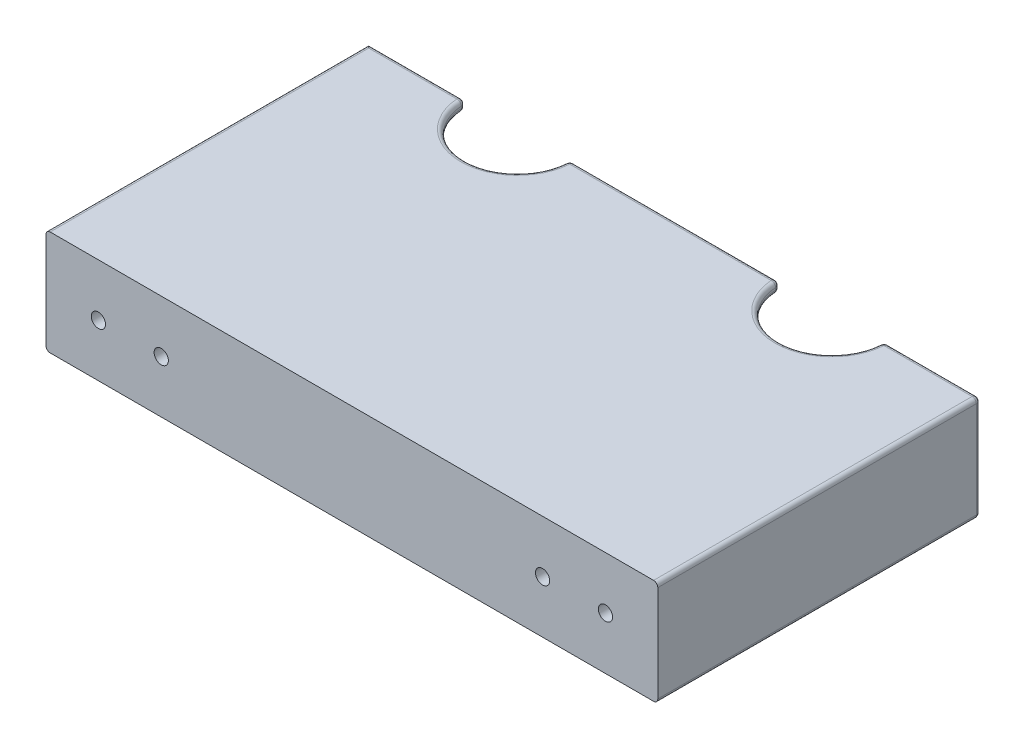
SolidWorks part; units mm, degrees
ref_plane "Front Plane" through (0, 0, 0) normal (0, 0, 1) x (1, 0, 0)
ref_plane "Top Plane" through (0, 0, 0) normal (0, 1, 0) x (1, 0, 0)
ref_plane "Right Plane" through (0, 0, 0) normal (1, 0, 0) x (0, 0, -1)
sketch "Sketch1" plane through (0, 0, 0) normal (0, 1, 0) x (1, 0, 0)
  line L1 (-73, 38.5) -> (73, 38.5)
  line L2 (-73, 38.5) -> (-73, -38.5)
  line L3 (-73, -38.5) -> (73, -38.5)
  line L4 (73, 38.5) -> (73, -38.5)
  line L5 (-73, 38.5) -> (73, -38.5) construction
  line L6 (-73, -38.5) -> (73, 38.5) construction
  point P0 (0, 0)
  dimension "D1" = 146
  dimension "D2" = 77
extrude "Boss-Extrude2" add sketch "Sketch1" along normal mid plane 25
sketch "Sketch3" plane through (0, 0, -38.5) normal (0, 0, -1) x (-1, 0, 0)
  line L1 (-70.5, -10) -> (70.5, -10)
  line L2 (-70.5, -10) -> (-70.5, 10)
  line L3 (-70.5, 10) -> (70.5, 10)
  line L4 (70.5, -10) -> (70.5, 10)
  line L5 (-70.5, -10) -> (70.5, 10) construction
  line L6 (-70.5, 10) -> (70.5, -10) construction
  point P0 (0, 0)
  dimension "D1" = 141
  dimension "D2" = 20
extrude "Cut-Extrude1" cut sketch "Sketch3" against normal blind 71
hole_wizard "CSK for M3 Countersunk Flat Head Screw1" positions "Sketch5" profile "Sketch6" countersink size "M3" standard "ISO"
sketch "Sketch5" plane through (0, 0, 32.5) normal (0, 0, -1) x (-1, 0, 0)
  line L0 (-70.5, 10) -> (-70.5, -10) construction
  line L1 (70.5, -10) -> (70.5, 10) construction
  point P0 (-60.5, 0)
  point P2 (-45.5, 0)
  point P4 (45.5, 0)
  point P6 (60.5, 0)
  point P13 (70.5, 0)
  dimension "D1" = 10
  dimension "D2" = 15
  dimension "D3" = 10
  dimension "D4" = 15
sketch "Sketch6" plane through (60.5, 0, 32.5) normal (1, 0, 0) x (0, 1, 0)
  line L0 (0, 0) -> (0, 9.0215)
  line L1 (0, 9.0215) -> (1.7, 8)
  line L2 (1.7, 8) -> (1.7, 1.45)
  line L3 (1.7, 1.45) -> (3.15, 0)
  line L5 (3.15, 0) -> (0, 0)
  line L6 (-1.7, 1.45) -> (-3.15, 0) construction
  line L10 (0, 9.0215) -> (-1.7, 8) construction
  line L11 (0, -6.35) -> (0, 107.95) construction
  dimension "Hole Dia." = 3.4
  dimension "Hole Depth" = 8
  dimension "Near C'Sink Dia." = 6.3
  dimension "Near C'Sink Angle" = 90
  dimension "Drill Angle" = 118
fillet "Fillet4" radius 1 17 edges at (0, 10, -38.5) (0, -10, -38.5) (-70.5, -10, -3) (-70.5, 0, 32.5) (-70.5, 10, -3) (-70.5, 0, -38.5) (70.5, 10, -3) (70.5, 0, 32.5) (70.5, -10, -3) (70.5, 0, -38.5) (0, -12.5, -38.5) (73, -12.5, 0) (73, 12.5, 0) (73, 0, -38.5) (0, 12.5, -38.5) (-73, -12.5, 0) (-73, 12.5, 0)
sketch "Sketch7" plane through (-73, 0, 0) normal (-1, 0, 0) x (0, 0, 1)
  line L0 (-38.5, 11.5) -> (-38.5, -11.5) construction
  line L1 (-30.5, -5) -> (30.5, -5)
  line L2 (-30.5, -5) -> (-30.5, 5)
  line L3 (-30.5, 5) -> (30.5, 5)
  line L4 (30.5, -5) -> (30.5, 5)
  line L5 (-30.5, -5) -> (30.5, 5) construction
  line L6 (-30.5, 5) -> (30.5, -5) construction
  point P0 (0, 0)
  dimension "D1" = 8
  dimension "D2" = 10
extrude "Cut-Extrude2" cut sketch "Sketch7" against normal blind 20
fillet "Fillet5" radius 1 4 edges at (-71.75, -5, 30.5) (-71.75, 5, 30.5) (-71.75, -5, -30.5) (-71.75, 5, -30.5)
sketch "Sketch9" plane through (0, 12.5, 0) normal (0, 1, 0) x (1, 0, 0)
  line L0 (0, 0) -> (0, 49.5387) construction
  line L1 (-50, 38.5) -> (-25, 38.5)
  line L2 (-73, 38.5) -> (72, 38.5) construction
  line L3 (-73, -38.5) -> (-73, 38.5) construction
  line L4 (50, 38.5) -> (25, 38.5)
  arc A0 (-50, 38.5) -> (-25, 38.5) centre (-37.5, 38.5) ccw
  arc A1 (50, 38.5) -> (25, 38.5) centre (37.5, 38.5) cw
  dimension "D1" = 35.5
  dimension "D2" = 25
extrude "Cut-Extrude3" cut sketch "Sketch9" against normal through all
fillet "Fillet6" radius 1 32 edges at (-25, -11.25, -38.5) (-50, -11.25, -38.5) (-25.0019, -12.1247, -38.2809) (-49.9943, -12.2816, -38.1238) (-37.5, -12.5, -26) (-25.0034, -10.2932, -38.2074) (-49.999, -10.4657, -38.3453) (-37.5, -10, -26) (-37.5, 12.5, -26) (-49.9981, 12.1247, -38.2809) (-25.0057, 12.2816, -38.1238) (-50, 11.25, -38.5) (-25, 11.25, -38.5) (-49.8826, 11.705, -36.7908) (-25.0019, 10.3753, -38.2809) (-37.5, 10, -26) (37.5, 12.5, -26) (25.0019, 12.1247, -38.2809) (49.9943, 12.2816, -38.1238) (25, 11.25, -38.5) (50, 11.25, -38.5) (25.1174, 11.705, -36.7908) (49.9981, 10.3753, -38.2809) (37.5, 10, -26) (50, -11.25, -38.5) (25, -11.25, -38.5) (49.9981, -12.1247, -38.2809) (25.0057, -12.2816, -38.1238) (37.5, -12.5, -26) (49.9966, -10.2932, -38.2074) (25.001, -10.4657, -38.3453) (37.5, -10, -26)
